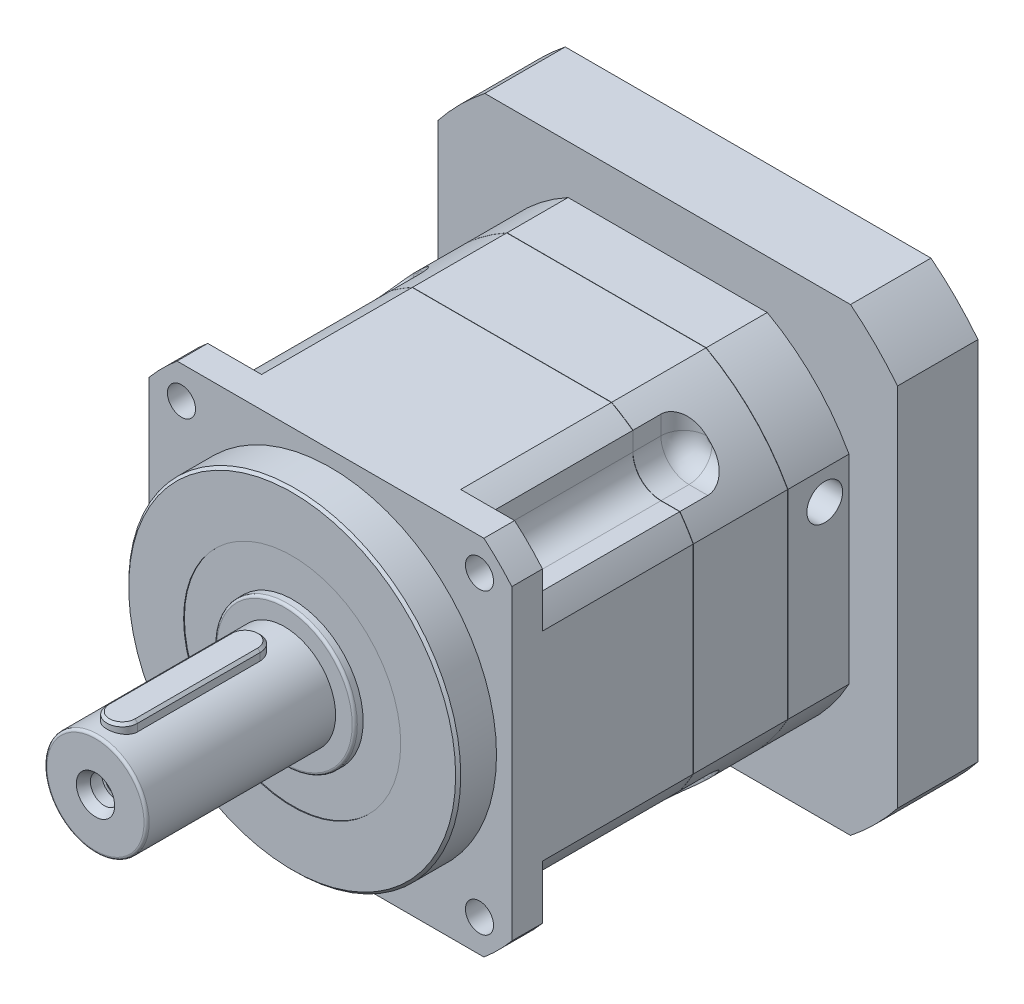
SolidWorks part; units mm, degrees
ref_plane "前视基准面" through (0, 0, 0) normal (0, 0, 1) x (1, 0, 0)
ref_plane "上视基准面" through (0, 0, 0) normal (0, 1, 0) x (1, 0, 0)
ref_plane "右视基准面" through (0, 0, 0) normal (1, 0, 0) x (0, 0, -1)
sketch "草图1" plane through (0, 0, 0) normal (0, 0, 1) x (1, 0, 0)
  line L1 (-60.0666, 71) -> (60.0666, 71)
  line L2 (-71, 60.0666) -> (-71, -60.0666)
  line L3 (-60.0666, -71) -> (60.0666, -71)
  line L4 (71, 60.0666) -> (71, -60.0666)
  arc A0 (-60.0666, 71) -> (-71, 60.0666) centre (0, 0) ccw
  arc A1 (-71, -60.0666) -> (-60.0666, -71) centre (0, 0) ccw
  arc A2 (60.0666, -71) -> (71, -60.0666) centre (0, 0) ccw
  arc A3 (71, 60.0666) -> (60.0666, 71) centre (0, 0) ccw
  dimension "D1" = 71
  dimension "D3" = 71
extrude "凸台-拉伸1" add sketch "草图1" along normal blind 12
sketch "草图2" plane through (0, 0, 12) normal (0, 0, 1) x (1, 0, 0)
  circle A0 centre (0, 0) radius 65
extrude "凸台-拉伸2" add sketch "草图2" along normal blind 15
sketch "草图3" plane through (0, 0, 0) normal (0, 0, -1) x (-1, 0, 0)
  line L0 (-60.0666, 71) -> (60.0666, 71) construction
  line L1 (71, 60.0666) -> (71, -60.0666) construction
  line L2 (60.0666, -71) -> (-60.0666, -71) construction
  line L3 (-71, -60.0666) -> (-71, 60.0666) construction
  line L4 (-38.9872, 71) -> (38.9872, 71)
  line L5 (71, 38.9872) -> (71, -38.9872)
  line L6 (38.9872, -71) -> (-38.9872, -71)
  line L7 (-71, -38.9872) -> (-71, 38.9872)
  arc A0 (-38.9872, 71) -> (-71, 38.9872) centre (0, 0) ccw
  arc A1 (-71, -38.9872) -> (-38.9872, -71) centre (0, 0) ccw
  arc A2 (38.9872, -71) -> (71, -38.9872) centre (0, 0) ccw
  arc A3 (71, 38.9872) -> (38.9872, 71) centre (0, 0) ccw
extrude "凸台-拉伸3" add sketch "草图3" along normal blind 59
sketch "草图4" plane through (0, 0, -59) normal (0, 0, -1) x (-1, 0, 0)
  line L1 (-78.3152, 74.0927) -> (-47.35, 74.0927)
  line L2 (-78.3152, 74.0927) -> (-78.3152, 47.35)
  line L3 (-78.3152, 47.35) -> (-47.35, 47.35)
  line L4 (-47.35, 74.0927) -> (-47.35, 47.35)
  dimension "D1" = 47.35
  dimension "D2" = 47.35
extrude "切除-拉伸1" cut sketch "草图4" against normal up to surface (59 mm away)
pattern_circular "阵列(圆周)1" count 4 over 360 about axis through (0, 0, 0) along (0, 0, 1) of "切除-拉伸1"
fillet "圆角1" radius 11 4 edges at (47.35, -47.35, -29.5) (-47.35, -47.35, -29.5) (-47.35, 47.35, -29.5) (47.35, 47.35, -29.5)
ref_plane "基准面1" through (0, 0, -59.1) normal (0, 0, -1) x (-1, 0, 0)
sketch "草图5" plane through (0, 0, -59.1) normal (0, 0, -1) x (-1, 0, 0)
  line L0 (38.9872, 71) -> (-38.9872, 71) construction
  line L1 (71, -38.9872) -> (71, 38.9872) construction
  line L2 (-38.9872, -71) -> (38.9872, -71) construction
  line L3 (-71, 38.9872) -> (-71, -38.9872) construction
  line L4 (38.9872, 71) -> (-38.9872, 71)
  line L5 (71, -38.9872) -> (71, 38.9872)
  line L6 (-38.9872, -71) -> (38.9872, -71)
  line L7 (-71, 38.9872) -> (-71, -38.9872)
  arc A0 (-38.9872, 71) -> (-71, 38.9872) centre (0, 0) ccw
  arc A1 (-71, -38.9872) -> (-38.9872, -71) centre (0, 0) ccw
  arc A2 (38.9872, -71) -> (71, -38.9872) centre (0, 0) ccw
  arc A3 (71, 38.9872) -> (38.9872, 71) centre (0, 0) ccw
extrude "凸台-拉伸4" add sketch "草图5" along normal blind 36.9 separate body
sketch "草图6" plane through (0, 0, -59.1) normal (0, 0, 1) x (1, 0, 0)
  line L0 (58.35, -47.35) -> (65.7189, -47.35) construction
  line L1 (47.35, -65.7189) -> (47.35, -58.35) construction
  line L2 (58.35, -47.35) -> (65.7189, -47.35)
  line L3 (47.35, -65.7189) -> (47.35, -58.35)
  arc A0 (58.35, -47.35) -> (47.35, -58.35) centre (58.35, -58.35) ccw construction
  arc A1 (58.35, -47.35) -> (47.35, -58.35) centre (58.35, -58.35) ccw
  arc A2 (47.35, -65.7189) -> (65.7189, -47.35) centre (0, 0) ccw
extrude "切除-拉伸2" cut sketch "草图6" against normal blind 19.9
pattern_circular "阵列(圆周)2" count 4 over 360 about axis through (0, 0, 0) along (0, 0, 1) of "切除-拉伸2"
fillet "圆角2" radius 9 12 edges at (-62.0345, -47.35, -79) (-50.5718, -50.5718, -79) (-62.0345, 47.35, -79) (-47.35, 62.0345, -79) (47.35, 62.0345, -79) (62.0345, 47.35, -79) (62.0345, -47.35, -79) (47.35, -62.0345, -79) (-47.35, -62.0345, -79) (-50.5718, 50.5718, -79) (50.5718, 50.5718, -79) (50.5718, -50.5718, -79)
ref_plane "基准面2" through (0, 0, -96.1) normal (0, 0, -1) x (-1, 0, 0)
sketch "草图7" plane through (0, 0, -96.1) normal (0, 0, -1) x (-1, 0, 0)
  line L1 (-38.9872, 71) -> (38.9872, 71)
  line L2 (-71, 38.9872) -> (-71, -38.9872)
  line L3 (-38.9872, -71) -> (38.9872, -71)
  line L4 (71, 38.9872) -> (71, -38.9872)
  arc A0 (-38.9872, 71) -> (-71, 38.9872) centre (0, 0) ccw
  arc A1 (-71, -38.9872) -> (-38.9872, -71) centre (0, 0) ccw
  arc A2 (38.9872, -71) -> (71, -38.9872) centre (0, 0) ccw
  arc A3 (71, 38.9872) -> (38.9872, 71) centre (0, 0) ccw
  dimension "D1" = 71
  dimension "D3" = 71
extrude "凸台-拉伸5" add sketch "草图7" along normal blind 23.9 separate body
sketch "草图8" plane through (0, 0, -120) normal (0, 0, -1) x (-1, 0, 0)
  line L1 (-90, 90) -> (90, 90)
  line L2 (-90, 90) -> (-90, -90)
  line L3 (-90, -90) -> (90, -90)
  line L4 (90, 90) -> (90, -90)
  dimension "D1" = 90
  dimension "D2" = 180
  dimension "D3" = 90
  dimension "D4" = 180
extrude "凸台-拉伸6" add sketch "草图8" along normal blind 31.5
sketch "草图9" plane through (0, 0, -151.5) normal (0, 0, -1) x (-1, 0, 0)
  circle A0 centre (0, 0) radius 115
extrude "切除-拉伸3" cut sketch "草图9" against normal up to surface (31.5 mm away) flip side to cut
sketch "草图10" plane through (0, 0, -151.5) normal (0, 0, -1) x (-1, 0, 0)
  circle A0 centre (0, 0) radius 57.15
extrude "切除-拉伸4" cut sketch "草图10" against normal blind 8
sketch "草图11" plane through (0, 0, -143.5) normal (0, 0, -1) x (-1, 0, 0)
  circle A0 centre (0, 0) radius 56
extrude "切除-拉伸5" cut sketch "草图11" against normal blind 10.5
sketch "草图12" plane through (0, 0, -133) normal (0, 0, -1) x (-1, 0, 0)
  circle A0 centre (0, 0) radius 41.5
extrude "切除-拉伸6" cut sketch "草图12" against normal blind 33
sketch "草图13" plane through (0, 0, -151.5) normal (0, 0, -1) x (-1, 0, 0)
  line L0 (0, 0) -> (-55, 0) construction
  circle A0 centre (0, 0) radius 55 construction
  circle A1 centre (-55, 0) radius 9
extrude "切除-拉伸7" cut sketch "草图13" against normal blind 39.5
pattern_circular "阵列(圆周)3" count 6 over 360 about axis through (0, 0, 0) along (0, 0, 1) of "切除-拉伸7"
sketch "草图14" plane through (0, 0, -151.5) normal (0, 0, -1) x (-1, 0, 0)
  line L0 (0, 0) -> (-81.3173, 81.3173) construction
  circle A0 centre (0, 0) radius 100 construction
  arc A1 (-71.5891, 90) -> (-90, 71.5891) centre (0, 0) ccw construction
hole_wizard "M12 螺纹孔1" positions "3D草图1" profile "草图15" tap size "M12" standard "GB"
sketch3d "3D草图1"
  line L0 (0, 0, -151.5) -> (81.3173, 81.3173, -151.5) construction
  circle A0 centre (0, 0, -151.5) radius 100 construction
  point P0 (70.7107, 70.7107, -151.5)
  point P6 (0, 0, -251.5)
sketch "草图15" plane through (70.7107, 70.7107, -151.5) normal (1, 0, 0) x (0, 1, 0)
  line L0 (0, 0) -> (0, 30.0644)
  line L1 (0, 30.0644) -> (5.1, 27)
  line L2 (5.1, 27) -> (5.1, 0)
  line L5 (5.1, 0) -> (0, 0)
  line L10 (0, 30.0644) -> (-5.1, 27) construction
  line L11 (0, -6.35) -> (0, 107.95) construction
  dimension "螺纹孔钻头直径" = 10.2
  dimension "螺纹孔钻头深度" = 27
  dimension "导头角度" = 118
pattern_circular "阵列(圆周)4" count 4 over 360 about axis through (0, 0, 0) along (0, 0, 1) of "M12 螺纹孔1"
ref_plane "基准面3" through (0, 0, -120.5) normal (0, 0, -1) x (-1, 0, 0)
sketch "草图16" plane through (0, 0, -120.5) normal (0, 0, -1) x (-1, 0, 0)
  circle A0 centre (0, 0) radius 37.5
extrude "凸台-拉伸7" add sketch "草图16" against normal up to surface (20.5 mm away)
chamfer "倒角1" distance 1 angle 45 1 edges at (-37.5, 0, -120.5)
sketch "草图17" plane through (0, 0, -151.5) normal (0, 0, -1) x (-1, 0, 0)
  circle A0 centre (0, 0) radius 19
extrude "切除-拉伸8" cut sketch "草图17" against normal blind 83.5
sketch "草图18" plane through (0, 0, -120.5) normal (0, 0, -1) x (-1, 0, 0)
  line L1 (-39.6206, 0.5) -> (39.5555, 0.5)
  line L2 (-39.6206, 0.5) -> (-39.6206, -0.5)
  line L3 (-39.6206, -0.5) -> (39.5555, -0.5)
  line L4 (39.5555, 0.5) -> (39.5555, -0.5)
  dimension "D1" = 0.5
  dimension "D2" = 1
extrude "切除-拉伸9" cut sketch "草图18" against normal up to surface (20.5 mm away)
chamfer "倒角2" distance 1 angle 45 1 edges at (65, 0, 27)
sketch "草图19" plane through (0, 0, 12) normal (0, 0, 1) x (1, 0, 0)
  line L0 (0, 0) -> (-65.7609, 65.7609) construction
  circle A0 centre (0, 0) radius 82.5 construction
  arc A1 (-60.0666, 71) -> (-71, 60.0666) centre (0, 0) ccw construction
  circle A2 centre (-58.3363, 58.3363) radius 5.5
extrude "切除-拉伸10" cut sketch "草图19" against normal blind 83.5
pattern_circular "阵列(圆周)5" count 4 over 360 about axis through (0, 0, 0) along (0, 0, 1) of "切除-拉伸10"
sketch "草图20" plane through (0, 0, 27) normal (0, 0, 1) x (1, 0, 0)
  circle A0 centre (0, 0) radius 27.5
extrude "凸台-拉伸8" add sketch "草图20" along normal blind 3
fillet "圆角3" radius 1 1 edges at (27.5, 0, 30)
sketch "草图21" plane through (0, 0, 30) normal (0, 0, 1) x (1, 0, 0)
  circle A0 centre (0, 0) radius 20
extrude "凸台-拉伸9" add sketch "草图21" along normal blind 74
fillet "圆角4" radius 1 1 edges at (20, 0, 104)
sketch "草图22" plane through (0, 0, 27) normal (0, 0, 1) x (1, 0, 0)
  circle A0 centre (0, 0) radius 42.5
  circle A1 centre (0, 0) radius 27.5
extrude "切除-拉伸11" cut sketch "草图22" against normal blind 0.3
sketch "草图23" plane through (0, 0, 0) normal (0, 1, 0) x (1, 0, 0)
  line L0 (-19, -104) -> (19, -104) construction
  line L1 (-6, -93.5) -> (-6, -45.5)
  line L2 (6, -45.5) -> (6, -93.5)
  arc A0 (-6, -93.5) -> (6, -93.5) centre (0, -93.5) ccw
  arc A1 (6, -45.5) -> (-6, -45.5) centre (0, -45.5) ccw
  dimension "D1" = 10.5
  dimension "D2" = 48
extrude "凸台-拉伸10" add sketch "草图23" along normal blind 23
chamfer "倒角3" distance 1 angle 45 4 edges at (-6, 23, 69.5) (0, 23, 99.5) (0, 23, 39.5) (6, 23, 69.5)
sketch "草图24" plane through (0, 0, -112) normal (0, 0, -1) x (-1, 0, 0)
  line L1 (-25.5263, 51.4473) -> (-29.8178, 51.2486)
  line L2 (-29.8178, 51.2486) -> (-31.7915, 47.4327)
  line L3 (-31.7915, 47.4327) -> (-29.4737, 43.8155)
  line L4 (-29.4737, 43.8155) -> (-25.1822, 44.0142)
  line L5 (-25.1822, 44.0142) -> (-23.2085, 47.8301)
  line L6 (-23.2085, 47.8301) -> (-25.5263, 51.4473)
  circle A0 centre (-27.5, 47.6314) radius 7.5
  circle A1 centre (-27.5, 47.6314) radius 3.7205 construction
extrude "凸台-拉伸11" add sketch "草图24" along normal blind 10
pattern_circular "阵列(圆周)6" count 6 over 360 about axis through (0, 0, 0) along (0, 0, 1) of "凸台-拉伸11"
sketch "草图25" plane through (0, 0, 104) normal (0, 0, 1) x (1, 0, 0)
  circle A0 centre (0, 0) radius 7.5
ref_plane "基准面4" through (0, 0, 100.5) normal (0, 0, 1) x (1, 0, 0)
sketch "草图26" plane through (0, 0, 100.5) normal (0, 0, 1) x (1, 0, 0)
  circle A0 centre (0, 0) radius 5.5
sketch "草图27" plane through (0, 0, 104) normal (0, 0, 1) x (1, 0, 0)
  circle A0 centre (0, 0) radius 5.5
extrude "切除-拉伸12" cut sketch "草图27" against normal blind 8
loft "切除-放样1" cut profiles "草图25", "草图26"
hole_wizard "M10 螺纹孔1" positions "3D草图2" profile "草图28" tap size "M10" standard "GB"
sketch3d "3D草图2"
  line L0 (0, 0, 96) -> (0, 0, 100.5) construction
  point P0 (0, 0, 96)
sketch "草图28" plane through (0, 0, 96) normal (1, 0, 0) x (0, -1, 0)
  line L0 (0, 0) -> (0, 27.5537)
  line L1 (0, 27.5537) -> (4.25, 25)
  line L2 (4.25, 25) -> (4.25, 0)
  line L5 (4.25, 0) -> (0, 0)
  line L10 (0, 27.5537) -> (-4.25, 25) construction
  line L11 (0, -6.35) -> (0, 107.95) construction
  dimension "螺纹孔钻头直径" = 8.5
  dimension "螺纹孔钻头深度" = 25
  dimension "导头角度" = 118
sketch "草图30" plane through (90, 0, 0) normal (1, 0, 0) x (0, 0, -1)
  line L0 (0, 0) -> (165.2932, 0) construction
  line L1 (151.5, 71.5891) -> (151.5, -71.5891) construction
  circle A0 centre (110.5, 27.5) radius 7
  dimension "D1" = 27.5
  dimension "D2" = 41
extrude "切除-拉伸13" cut sketch "草图30" against normal up to surface (66.9349 mm away)
pattern_circular "阵列(圆周)7" count 2 over 360 about axis through (0, 0, -110.5) along (1, 0, 0) of "切除-拉伸13"
